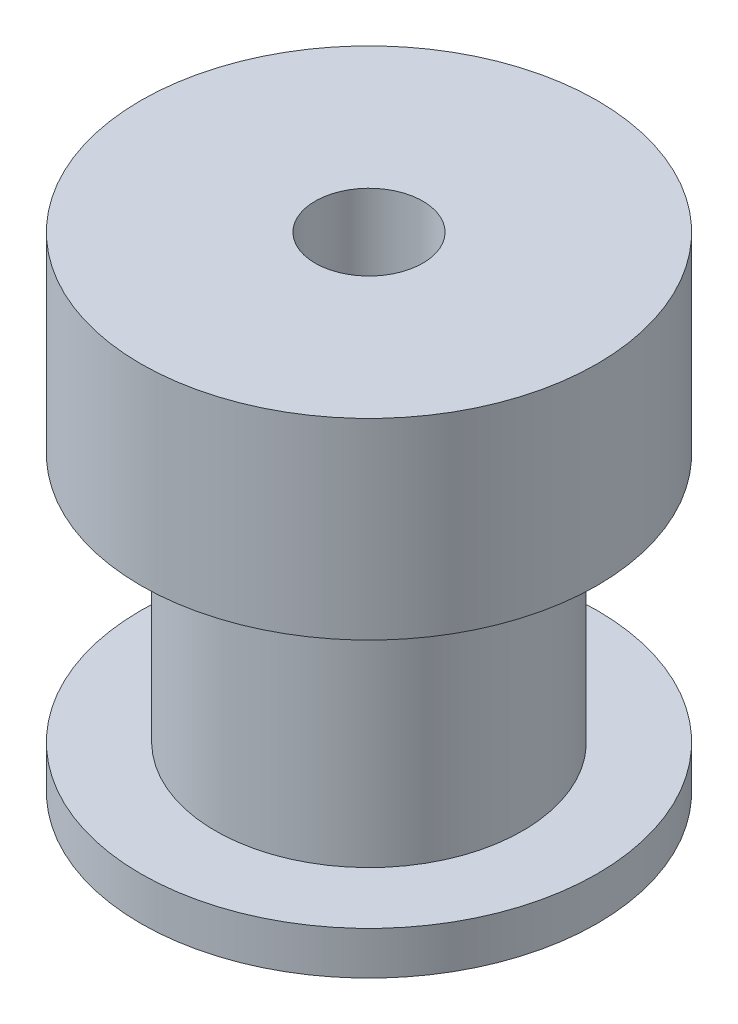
SolidWorks part; units mm, degrees
ref_plane "Front Plane" through (0, 0, 0) normal (0, 0, 1) x (1, 0, 0)
ref_plane "Top Plane" through (0, 0, 0) normal (0, 1, 0) x (1, 0, 0)
ref_plane "Right Plane" through (0, 0, 0) normal (1, 0, 0) x (0, 0, -1)
sketch "Sketch1" plane through (0, 0, 0) normal (0, 1, 0) x (1, 0, 0)
  circle A0 centre (0, 0) radius 6.731
  dimension "D1" = 13.462
extrude "Boss-Extrude1" add sketch "Sketch1" along normal blind 14.3002
sketch "Sketch2" plane through (0, 0, 0) normal (1, 0, 0) x (0, 0, -1)
  line L0 (-6.731, 14.3002) -> (-6.731, 0) construction
  line L1 (-6.731, 1.27) -> (-4.5339, 1.27)
  line L2 (-6.731, 1.27) -> (-6.731, 8.636)
  line L3 (-6.731, 8.636) -> (-4.5339, 8.636)
  line L4 (-4.5339, 1.27) -> (-4.5339, 8.636)
  line L5 (-6.731, 0) -> (6.731, 0) construction
  line L6 (0, 0) -> (0, 14.9193) construction
  dimension "D1" = 7.366
  dimension "D2" = 1.27
  dimension "D3" = 4.5339
revolve "Cut-Revolve1" cut sketch "Sketch2" angle 360 about L6
sketch "Sketch3" plane through (0, 14.3002, 0) normal (0, 1, 0) x (1, 0, 0)
  circle A0 centre (0, 0) radius 1.5875
  dimension "D1" = 3.175
extrude "Cut-Extrude1" cut sketch "Sketch3" against normal through all
